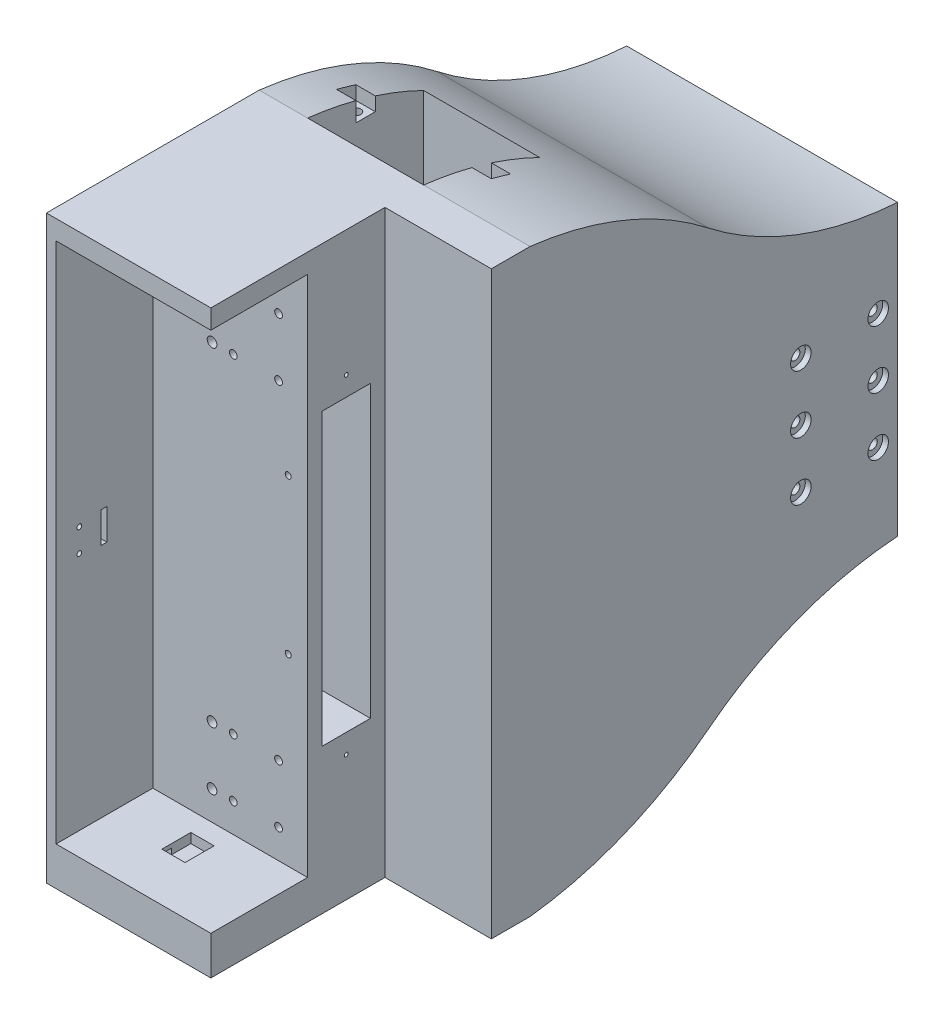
SolidWorks part; units mm, degrees
ref_plane "前视基准面" through (0, 0, 0) normal (0, 0, 1) x (1, 0, 0)
ref_plane "上视基准面" through (0, 0, 0) normal (0, 1, 0) x (1, 0, 0)
ref_plane "右视基准面" through (0, 0, 0) normal (1, 0, 0) x (0, 0, -1)
other "Configuration Table"
sketch "草图1" plane through (0, 0, 0) normal (0, 1, 0) x (1, 0, 0)
  line L0 (0, 0) -> (140, 0)
  line L1 (140, 0) -> (140, -20)
  line L2 (140, -20) -> (85, -20)
  line L3 (85, -20) -> (85, -100)
  line L4 (85, -100) -> (0, -100)
  line L5 (0, -100) -> (0, 0)
  dimension "D1" = 140
  dimension "D2" = 100
  dimension "D3" = 80
  dimension "D4" = 55
extrude "凸台-拉伸1" add sketch "草图1" along normal blind 300
sketch "草图3" plane through (85, 0, 0) normal (1, 0, 0) x (0, 0, -1)
  line L0 (-100, 0) -> (-100, 10)
  line L1 (-100, 10) -> (-50, 10)
  line L2 (-50, 10) -> (-50, 290)
  line L3 (-50, 290) -> (-100, 290)
  line L4 (-100, 0) -> (-20, 0)
  line L5 (-20, 0) -> (-20, 300)
  line L6 (-20, 300) -> (-100, 300)
  line L7 (-100, 300) -> (-100, 0)
  line L8 (-100, 0) -> (-20, 0)
  line L9 (-20, 0) -> (-20, 300)
  line L10 (-20, 300) -> (-100, 300)
  line L11 (-100, 300) -> (-100, 0)
  line L12 (-100, 290) -> (-100, 10)
  dimension "D2" = 10
  dimension "D3" = 10
  dimension "D4" = 50
  dimension "D1" = 0
extrude "切除-拉伸1" cut sketch "草图3" against normal blind 80 contours L2 L3 L1 M10
sketch "草图5" plane through (0, 0, 50) normal (0, 0, 1) x (1, 0, 0)
  line L0 (70, 10) -> (70, 35)
  line L1 (70, 35) -> (85, 35)
  line L2 (46.6, 35) -> (46.6, 65) construction
  line L3 (46.6, 65) -> (46.6, 265) construction
  line L4 (85, 10) -> (85, 290)
  line L5 (85, 290) -> (5, 290)
  line L6 (5, 290) -> (5, 10)
  line L7 (5, 10) -> (85, 10)
  line L8 (85, 10) -> (85, 290)
  line L9 (85, 290) -> (5, 290)
  line L10 (5, 290) -> (5, 10)
  line L11 (5, 10) -> (85, 10)
  circle A0 centre (70, 35) radius 2
  circle A1 centre (46.6, 35) radius 2
  circle A2 centre (46.6, 65) radius 2
  circle A3 centre (70, 65) radius 2
  circle A4 centre (46.6, 265) radius 2
  circle A5 centre (46.6, 235) radius 2
  circle A6 centre (70, 235) radius 2
  circle A7 centre (70, 265) radius 2
  dimension "D4" = 4
  dimension "D2" = 25
  dimension "D3" = 15
  dimension "D6" = 23.4
  dimension "D8" = 30
  dimension "D10" = 200
  dimension "D1" = 0
  dimension "D5" = 2
  dimension "D7" = 2
  dimension "D9" = 2
extrude "切除-拉伸2" cut sketch "草图5" against normal blind 50 contours A2 | A3 | A1 | L1 A0 L0 | L0 A0 L1 | A6 | A4 | A7 | A5
sketch "草图9" plane through (0, 0, 50) normal (0, 0, 1) x (1, 0, 0)
  line L0 (46.6, 265) -> (35.6, 265)
  line L1 (46.6, 235) -> (35.6, 235)
  line L2 (46.6, 65) -> (35.6, 65)
  line L3 (46.6, 35) -> (35.6, 35)
  circle A0 centre (46.6, 265) radius 2 construction
  circle A1 centre (46.6, 265) radius 2
  circle A2 centre (46.6, 235) radius 2 construction
  circle A3 centre (46.6, 235) radius 2
  circle A4 centre (46.6, 65) radius 2 construction
  circle A5 centre (46.6, 65) radius 2
  circle A6 centre (46.6, 35) radius 2 construction
  circle A7 centre (46.6, 35) radius 2
  circle A8 centre (35.6, 265) radius 2.5
  circle A9 centre (35.6, 235) radius 2.5
  circle A10 centre (35.6, 65) radius 2.5
  circle A11 centre (35.6, 35) radius 2.5
  dimension "D3" = 5
  dimension "D4" = 5
  dimension "D7" = 5
  dimension "D8" = 5
  dimension "D1" = 11
  dimension "D2" = 11
  dimension "D5" = 11
  dimension "D6" = 11
extrude "切除-拉伸3" cut sketch "草图9" against normal blind 50
sketch "草图11" plane through (0, 0, 0) normal (0, 0, -1) x (-1, 0, 0)
  line L4 (-140, 0) -> (0, 0)
  line L5 (0, 0) -> (0, 300)
  line L6 (0, 300) -> (-140, 300)
  line L7 (-140, 300) -> (-140, 0)
  line L8 (-140, 0) -> (0, 0)
  line L9 (0, 0) -> (0, 300)
  line L10 (0, 300) -> (-140, 300)
  line L11 (-140, 300) -> (-140, 0)
  circle A0 centre (-35.6, 35) radius 2.5 construction
  circle A1 centre (-46.6, 235) radius 2
  circle A2 centre (-46.6, 235) radius 2
  circle A3 centre (-70, 265) radius 2
  circle A4 centre (-70, 265) radius 2
  circle A5 centre (-46.6, 265) radius 2
  circle A6 centre (-46.6, 265) radius 2
  circle A7 centre (-70, 235) radius 2
  circle A8 centre (-70, 235) radius 2
  circle A9 centre (-35.6, 235) radius 2.5
  circle A10 centre (-35.6, 235) radius 2.5
  circle A11 centre (-35.6, 265) radius 2.5
  circle A12 centre (-35.6, 265) radius 2.5
  circle A13 centre (-35.6, 65) radius 2.5 construction
  circle A14 centre (-46.6, 65) radius 2 construction
  circle A15 centre (-46.6, 35) radius 2 construction
  circle A16 centre (-70, 35) radius 2 construction
  circle A17 centre (-70, 65) radius 2 construction
  circle A18 centre (-35.6, 35) radius 2.5
  circle A19 centre (-35.6, 65) radius 2.5
  circle A20 centre (-46.6, 65) radius 2
  circle A21 centre (-46.6, 35) radius 2
  circle A22 centre (-70, 35) radius 2
  circle A23 centre (-70, 65) radius 2
  dimension "D1" = 0
  dimension "D2" = 0
  dimension "D3" = 0
  dimension "D4" = 0
  dimension "D5" = 0
  dimension "D6" = 0
  dimension "D7" = 0
extrude "凸台-拉伸3" add sketch "草图11" along normal blind 10
sketch "草图12" plane through (0, 0, 20) normal (0, 0, 1) x (1, 0, 0)
  line L4 (85, 0) -> (140, 0)
  line L5 (140, 0) -> (140, 300)
  line L6 (140, 300) -> (85, 300)
  line L7 (85, 300) -> (85, 0)
  line L8 (85, 0) -> (140, 0)
  line L9 (140, 0) -> (140, 300)
  line L10 (140, 300) -> (85, 300)
  line L11 (85, 300) -> (85, 0)
  dimension "D1" = 0
extrude "切除-拉伸4" cut sketch "草图12" against normal blind 10
sketch "草图13" plane through (140, 0, 0) normal (1, 0, 0) x (0, 0, -1)
  line L0 (10, 150) -> (10, 224.75)
  line L1 (200, 150) -> (200, 75.25)
  line L2 (200, 150) -> (200, 224.75)
  line L3 (200, 150) -> (-49800, 150) construction
  line L4 (-10, 300) -> (-10, 0)
  line L5 (-10, 0) -> (10, 0)
  line L6 (10, 0) -> (10, 300)
  line L7 (10, 300) -> (-10, 300)
  line L8 (-10, 300) -> (-10, 0)
  line L9 (-10, 0) -> (10, 0)
  line L10 (10, 0) -> (10, 300)
  line L11 (10, 300) -> (-10, 300)
  arc A0 (200, 224.75) -> (102.1356, 262.2094) centre (212.2529, 403.3284) cw
  arc A1 (102.1356, 37.7906) -> (10, 0) centre (-11.3173, 183.1842) cw
  arc A2 (102.1356, 262.2094) -> (10, 300) centre (-11.3173, 116.8158) ccw
  arc A3 (200, 75.25) -> (102.1356, 37.7906) centre (212.2529, -103.3284) ccw
  dimension "D2" = 74.75
  dimension "D4" = 190
  dimension "D1" = 0
  dimension "D3" = 2
extrude "凸台-拉伸4" add sketch "草图13" against normal up to surface (140 mm away)
sketch "草图15" plane through (0, 0, 0) normal (-1, 0, 0) x (0, 0, 1)
  line L0 (-10, 300) -> (100, 300) construction
  line L1 (-10, 300) -> (100, 300)
  line L2 (-10, 0) -> (100, 0) construction
  line L3 (-10, 0) -> (100, 0)
  line L4 (-10, 0) -> (-10, 80)
  line L5 (-10, 300) -> (-10, 220)
  line L6 (-10, 80) -> (-70, 80)
  line L7 (-10, 220) -> (-70, 220)
  line L8 (-70, 80) -> (-70, 17.6597)
  line L9 (-70, 220) -> (-70, 282.3403)
  arc A0 (-102.1356, 37.7906) -> (-10, 0) centre (11.3173, 183.1842) ccw construction
  arc A1 (-10, 300) -> (-102.1356, 262.2094) centre (11.3173, 116.8158) ccw construction
  arc A2 (-10, 300) -> (-102.1356, 262.2094) centre (11.3173, 116.8158) ccw
  arc A3 (-102.1356, 37.7906) -> (-10, 0) centre (11.3173, 183.1842) ccw
  dimension "D3" = 60
  dimension "D1" = 80
  dimension "D2" = 80
  dimension "D4" = 60
extrude "切除-拉伸5" cut sketch "草图15" against normal blind 60 from offset 25 contours L6 L8 L4 M12 | L9 L7 L5 M8
sketch "草图16" plane through (85, 0, 0) normal (1, 0, 0) x (0, 0, -1)
  line L0 (-50, 150) -> (-42.5, 150)
  line L1 (-42.5, 75) -> (-42.5, 225)
  line L2 (-42.5, 225) -> (-17.5, 225)
  line L3 (-17.5, 225) -> (-17.5, 75)
  line L4 (-17.5, 150) -> (-42.5, 150)
  line L5 (-42.5, 75) -> (-17.5, 75)
  line L8 (-50, 290) -> (-50, 10)
  line L9 (-50, 10) -> (-100, 10)
  line L10 (-100, 10) -> (-100, 0)
  line L11 (-100, 0) -> (-10, 0)
  line L12 (-10, 0) -> (-10, 300)
  line L13 (-10, 300) -> (-100, 300)
  line L14 (-100, 300) -> (-100, 290)
  line L15 (-100, 290) -> (-50, 290)
  line L16 (-50, 290) -> (-50, 10)
  line L17 (-50, 10) -> (-100, 10)
  line L18 (-100, 10) -> (-100, 0)
  line L19 (-100, 0) -> (-10, 0)
  line L20 (-10, 0) -> (-10, 300)
  line L21 (-10, 300) -> (-100, 300)
  line L22 (-100, 300) -> (-100, 290)
  line L23 (-100, 290) -> (-50, 290)
  dimension "D2" = 7.5
  dimension "D3" = 25
  dimension "D4" = 75
  dimension "D1" = 0
extrude "切除-拉伸6" cut sketch "草图16" against normal blind 60 contours L4 L3 L2 L1 | L1 L5 L3 L4
sketch "草图17" plane through (0, 0, -200) normal (0, 0, -1) x (-1, 0, 0)
  line L1 (-120, 194.75) -> (-20, 194.75)
  line L2 (-120, 194.75) -> (-120, 105.25)
  line L3 (-120, 105.25) -> (-20, 105.25)
  line L4 (0, 75.25) -> (0, 224.75)
  line L5 (0, 224.75) -> (-140, 224.75)
  line L6 (-140, 224.75) -> (-140, 75.25)
  line L7 (-140, 75.25) -> (0, 75.25)
  line L8 (0, 75.25) -> (0, 224.75)
  line L9 (0, 224.75) -> (-140, 224.75)
  line L10 (-140, 224.75) -> (-140, 75.25)
  line L11 (-140, 75.25) -> (0, 75.25)
  line L12 (-20, 194.75) -> (-20, 105.25)
  line L13 (-120, 194.75) -> (-20, 105.25) construction
  line L14 (-120, 105.25) -> (-20, 194.75) construction
  point P2 (-70, 150)
  dimension "D2" = 100
  dimension "D3" = 89.5
  dimension "D4" = 20
  dimension "D5" = 30
  dimension "D1" = 0
extrude "切除-拉伸8" cut sketch "草图17" against normal blind 61 contours L12 L1 L2 L3
sketch "草图19" plane through (20, 0, 0) normal (1, 0, 0) x (0, 0, -1)
  line L0 (200, 150) -> (139, 150)
  line L1 (190, 150) -> (150, 150) construction
  line L2 (190, 150) -> (190, 180) construction
  line L4 (200, 105.25) -> (200, 194.75)
  line L5 (200, 194.75) -> (139, 194.75)
  line L6 (139, 194.75) -> (139, 105.25)
  line L7 (139, 105.25) -> (200, 105.25)
  line L8 (200, 105.25) -> (200, 194.75)
  line L9 (200, 194.75) -> (139, 194.75)
  line L10 (139, 194.75) -> (139, 105.25)
  line L11 (139, 105.25) -> (200, 105.25)
  circle A0 centre (190, 150) radius 2.5
  circle A1 centre (150, 150) radius 2.5
  circle A2 centre (150, 180) radius 2.5
  circle A3 centre (190, 180) radius 2.5
  circle A4 centre (150, 120) radius 2.5
  circle A5 centre (190, 120) radius 2.5
  dimension "D2" = 5
  dimension "D3" = 10
  dimension "D6" = 40
  dimension "D7" = 30
  dimension "D1" = 0
  dimension "D4" = 2
  dimension "D5" = 2
extrude "切除-拉伸9" cut sketch "草图19" against normal through all both and the other way through all contours A3 | A2 | A1 | A0 | A5 | A4
sketch "草图20" plane through (140, 0, 0) normal (1, 0, 0) x (0, 0, -1)
  circle A0 centre (150, 120) radius 2.5 construction
  circle A1 centre (190, 120) radius 2.5 construction
  circle A2 centre (190, 150) radius 2.5 construction
  circle A3 centre (150, 150) radius 2.5 construction
  circle A4 centre (150, 180) radius 2.5 construction
  circle A5 centre (190, 180) radius 2.5 construction
  circle A6 centre (150, 120) radius 2.5
  circle A7 centre (190, 120) radius 2.5
  circle A8 centre (190, 150) radius 2.5
  circle A9 centre (150, 150) radius 2.5
  circle A10 centre (150, 180) radius 2.5
  circle A11 centre (190, 180) radius 2.5
  circle A12 centre (190, 180) radius 5.3
  circle A13 centre (150, 180) radius 5.3
  circle A14 centre (150, 150) radius 5.3
  circle A15 centre (190, 150) radius 5.3
  circle A16 centre (190, 120) radius 5.3
  circle A17 centre (150, 120) radius 5.3
  dimension "D1" = 10.6
  dimension "D2" = 10.6
  dimension "D3" = 10.6
  dimension "D4" = 10.6
  dimension "D5" = 10.6
  dimension "D6" = 10.6
extrude "切除-拉伸10" cut sketch "草图20" against normal blind 3 and the other way through all
sketch "草图21" plane through (0, 0, 0) normal (-1, 0, 0) x (0, 0, 1)
  circle A0 centre (-150, 120) radius 5.3 construction
  circle A1 centre (-150, 150) radius 5.3
  circle A2 centre (-150, 150) radius 5.3
  circle A3 centre (-150, 180) radius 5.3 construction
  circle A4 centre (-190, 180) radius 5.3 construction
  circle A5 centre (-190, 150) radius 5.3 construction
  circle A6 centre (-190, 120) radius 5.3 construction
  circle A7 centre (-150, 120) radius 5.3
  circle A8 centre (-150, 180) radius 5.3
  circle A9 centre (-190, 180) radius 5.3
  circle A10 centre (-190, 150) radius 5.3
  circle A11 centre (-190, 120) radius 5.3
  dimension "D1" = 0
extrude "切除-拉伸11" cut sketch "草图21" against normal blind 3
sketch "草图22" plane through (0, 0, -139) normal (0, 0, -1) x (-1, 0, 0)
  line L0 (-70, 194.75) -> (-70, 105.25)
  line L1 (-120, 150) -> (-20, 150)
  line L3 (-105.5, 185.5) -> (-34.5, 185.5)
  line L4 (-20, 105.25) -> (-20, 194.75)
  line L5 (-20, 194.75) -> (-120, 194.75)
  line L6 (-120, 194.75) -> (-120, 105.25)
  line L7 (-120, 105.25) -> (-20, 105.25)
  line L8 (-20, 105.25) -> (-20, 194.75)
  line L9 (-20, 194.75) -> (-120, 194.75)
  line L10 (-120, 194.75) -> (-120, 105.25)
  line L11 (-120, 105.25) -> (-20, 105.25)
  line L12 (-105.5, 185.5) -> (-105.5, 114.5)
  line L13 (-105.5, 114.5) -> (-34.5, 114.5)
  line L14 (-34.5, 185.5) -> (-34.5, 114.5)
  line L15 (-105.5, 185.5) -> (-34.5, 114.5) construction
  line L16 (-105.5, 114.5) -> (-34.5, 185.5) construction
  point P8 (-70, 150)
  dimension "D2" = 71
  dimension "D3" = 71
  dimension "D1" = 0
extrude "切除-拉伸12" cut sketch "草图22" against normal blind 71 contours L3 L12 L1 L0 | L14 L3 L0 L1 | L14 L1 L0 L13 | L12 L13 L0 L1
sketch "草图23" plane through (0, 0, 0) normal (-1, 0, 0) x (0, 0, 1)
  line L0 (100, 150) -> (90, 150)
  line L1 (90, 160) -> (90, 140)
  line L2 (90, 140) -> (70, 140)
  line L3 (70, 140) -> (70, 160)
  line L4 (-10, 0) -> (100, 0)
  line L5 (100, 0) -> (100, 300)
  line L6 (100, 300) -> (-10, 300)
  line L7 (-200, 224.75) -> (-200, 75.25)
  line L8 (-10, 0) -> (100, 0)
  line L9 (100, 0) -> (100, 300)
  line L10 (100, 300) -> (-10, 300)
  line L11 (-200, 224.75) -> (-200, 75.25)
  line L12 (70, 150) -> (90, 150)
  line L13 (90, 160) -> (70, 160)
  arc A4 (-10, 300) -> (-102.1356, 262.2094) centre (11.3173, 116.8158) ccw
  arc A5 (-200, 224.75) -> (-102.1356, 262.2094) centre (-212.2529, 403.3284) ccw
  arc A6 (-102.1356, 37.7906) -> (-200, 75.25) centre (-212.2529, -103.3284) ccw
  arc A7 (-102.1356, 37.7906) -> (-10, 0) centre (11.3173, 183.1842) ccw
  arc A8 (-10, 300) -> (-102.1356, 262.2094) centre (11.3173, 116.8158) ccw
  arc A9 (-200, 224.75) -> (-102.1356, 262.2094) centre (-212.2529, 403.3284) ccw
  arc A10 (-102.1356, 37.7906) -> (-200, 75.25) centre (-212.2529, -103.3284) ccw
  arc A11 (-102.1356, 37.7906) -> (-10, 0) centre (11.3173, 183.1842) ccw
  dimension "D2" = 10
  dimension "D3" = 20
  dimension "D4" = 10
  dimension "D1" = 0
extrude "切除-拉伸13" cut sketch "草图23" against normal blind 2 contours L12 L3 L2 L1 | L1 L13 L3 L12
sketch "草图24" plane through (2, 0, 0) normal (-1, 0, 0) x (0, 0, 1)
  line L0 (70, 142) -> (73.75, 142)
  line L1 (73.75, 142) -> (73.75, 140)
  line L3 (73.75, 142) -> (76.75, 142)
  line L4 (90, 140) -> (90, 160)
  line L5 (90, 160) -> (70, 160)
  line L6 (70, 160) -> (70, 140)
  line L7 (70, 140) -> (90, 140)
  line L8 (90, 140) -> (90, 160)
  line L9 (90, 160) -> (70, 160)
  line L10 (70, 160) -> (70, 140)
  line L11 (70, 140) -> (90, 140)
  line L12 (73.75, 142) -> (73.75, 158)
  line L13 (73.75, 158) -> (76.75, 158)
  line L14 (76.75, 142) -> (76.75, 158)
  dimension "D2" = 3.75
  dimension "D3" = 2
  dimension "D4" = 16
  dimension "D5" = 3
  dimension "D1" = 0
extrude "切除-拉伸14" cut sketch "草图24" against normal blind 12 contours L3 L14 L13 L12
sketch "草图25" plane through (2, 0, 0) normal (-1, 0, 0) x (0, 0, 1)
  line L0 (90, 150) -> (88, 150)
  line L1 (88, 150) -> (88, 156)
  line L4 (90, 140) -> (90, 160)
  line L5 (90, 160) -> (70, 160)
  line L6 (70, 160) -> (70, 140)
  line L7 (70, 140) -> (90, 140)
  line L8 (90, 140) -> (90, 160)
  line L9 (90, 160) -> (70, 160)
  line L10 (70, 160) -> (70, 140)
  line L11 (70, 140) -> (90, 140)
  circle A0 centre (88, 156) radius 1.25
  circle A1 centre (88, 144) radius 1.25
  dimension "D4" = 2.5
  dimension "D2" = 2
  dimension "D3" = 6
  dimension "D1" = 0
extrude "切除-拉伸15" cut sketch "草图25" against normal blind 12
sketch "草图26" plane through (0, 10, 0) normal (0, 1, 0) x (1, 0, 0)
  line L4 (85, -100) -> (85, -50)
  line L5 (85, -50) -> (5, -50)
  line L6 (5, -50) -> (5, -100)
  line L7 (5, -100) -> (85, -100)
  line L8 (85, -100) -> (85, -50)
  line L9 (85, -50) -> (5, -50)
  line L10 (5, -50) -> (5, -100)
  line L11 (5, -100) -> (85, -100)
  dimension "D1" = 0
extrude "凸台-拉伸5" add sketch "草图26" along normal blind 10
sketch "草图28" plane through (0, 0, 0) normal (0, -1, 0) x (1, 0, 0)
  line L0 (0, -10) -> (0, 100) construction
  line L1 (0, -10) -> (0, 100)
  line L2 (40.6621, 100) -> (40.6621, 91)
  line L3 (40.6621, 91) -> (17.6621, 91)
  line L4 (17.6621, 91) -> (17.6621, 70)
  line L5 (17.6621, 70) -> (63.6621, 70)
  line L6 (63.6621, 70) -> (63.6621, 91)
  line L7 (63.6621, 91) -> (40.6621, 91)
  line L10 (140, 10) -> (85, 10)
  line L11 (85, 10) -> (85, 100)
  line L12 (85, 100) -> (0, 100)
  line L13 (0, 100) -> (0, -10)
  line L14 (0, -10) -> (25, -10)
  line L15 (25, -10) -> (85, -10)
  line L16 (85, -10) -> (140, -10)
  line L17 (140, -10) -> (140, 10)
  line L18 (140, 10) -> (85, 10)
  line L19 (85, 10) -> (85, 100)
  line L20 (85, 100) -> (0, 100)
  line L21 (0, 100) -> (0, -10)
  line L22 (0, -10) -> (25, -10)
  line L23 (25, -10) -> (85, -10)
  line L24 (85, -10) -> (140, -10)
  line L25 (140, -10) -> (140, 10)
  dimension "D2" = 9
  dimension "D3" = 46
  dimension "D4" = 23
  dimension "D5" = 21
  dimension "D1" = 0
extrude "切除-拉伸16" cut sketch "草图28" against normal blind 18 contours L6 L7 L3 L4 L5
sketch "草图29" plane through (0, 18, 0) normal (0, -1, 0) x (1, 0, 0)
  line L0 (40.6621, 70) -> (46.6621, 70)
  line L1 (46.6621, 70) -> (46.6621, 75)
  line L2 (46.6621, 75) -> (34.6621, 75)
  line L3 (34.6621, 75) -> (34.6621, 70)
  line L4 (63.6621, 70) -> (63.6621, 91)
  line L5 (63.6621, 91) -> (17.6621, 91)
  line L6 (17.6621, 91) -> (17.6621, 70)
  line L7 (17.6621, 70) -> (63.6621, 70)
  line L8 (63.6621, 70) -> (63.6621, 91)
  line L9 (63.6621, 91) -> (17.6621, 91)
  line L10 (17.6621, 91) -> (17.6621, 70)
  line L11 (17.6621, 70) -> (63.6621, 70)
  line L12 (34.6621, 70) -> (40.6621, 70)
  dimension "D2" = 12
  dimension "D3" = 5
  dimension "D4" = 6
  dimension "D1" = 0
extrude "切除-拉伸17" cut sketch "草图29" against normal blind 10 contours L2 L3 L1 M13
sketch "草图30" plane through (0, 20, 0) normal (0, 1, 0) x (1, 0, 0)
  line L0 (46.6621, -70) -> (34.6621, -70) construction
  line L1 (46.6621, -70) -> (34.6621, -70)
  line L2 (46.6621, -75) -> (46.6621, -70) construction
  line L3 (46.6621, -75) -> (46.6621, -70)
  line L4 (5, -100) -> (85, -100)
  line L5 (85, -100) -> (85, -50)
  line L6 (85, -50) -> (5, -50)
  line L7 (5, -50) -> (5, -100)
  line L8 (5, -100) -> (85, -100)
  line L9 (85, -100) -> (85, -50)
  line L10 (85, -50) -> (5, -50)
  line L11 (5, -50) -> (5, -100)
  line L12 (34.6621, -75) -> (46.6621, -75) construction
  line L13 (34.6621, -70) -> (34.6621, -75) construction
  line L14 (34.6621, -75) -> (46.6621, -75)
  line L15 (34.6621, -70) -> (34.6621, -75)
  line L16 (34.6621, -70) -> (34.6621, -60)
  line L17 (34.6621, -60) -> (46.6621, -60)
  line L18 (46.6621, -60) -> (46.6621, -70)
  dimension "D2" = 10
  dimension "D1" = 0
extrude "切除-拉伸18" cut sketch "草图30" against normal blind 5 contours L18 L17 L16 M8
sketch "草图31" plane through (85, 0, 0) normal (1, 0, 0) x (0, 0, -1)
  line L0 (-30, 225) -> (-30, 235)
  line L1 (-30, 75) -> (-30, 65)
  line L4 (-42.5, 225) -> (-42.5, 75)
  line L5 (-42.5, 75) -> (-17.5, 75)
  line L6 (-17.5, 75) -> (-17.5, 225)
  line L7 (-17.5, 225) -> (-42.5, 225)
  line L8 (-50, 290) -> (-50, 20)
  line L9 (-50, 20) -> (-100, 20)
  line L10 (-100, 20) -> (-100, 0)
  line L11 (-100, 0) -> (-10, 0)
  line L12 (-10, 0) -> (-10, 300)
  line L13 (-10, 300) -> (-100, 300)
  line L14 (-100, 300) -> (-100, 290)
  line L15 (-100, 290) -> (-50, 290)
  line L16 (-50, 290) -> (-50, 20)
  line L17 (-50, 20) -> (-100, 20)
  line L18 (-100, 20) -> (-100, 0)
  line L19 (-100, 0) -> (-10, 0)
  line L20 (-10, 0) -> (-10, 300)
  line L21 (-10, 300) -> (-100, 300)
  line L22 (-100, 300) -> (-100, 290)
  line L23 (-100, 290) -> (-50, 290)
  line L24 (-42.5, 225) -> (-42.5, 75)
  line L25 (-42.5, 75) -> (-17.5, 75)
  line L26 (-17.5, 75) -> (-17.5, 225)
  line L27 (-17.5, 225) -> (-42.5, 225)
  circle A0 centre (-30, 235) radius 1
  circle A1 centre (-30, 65) radius 1
  dimension "D5" = 2
  dimension "D6" = 2
  dimension "D3" = 10
  dimension "D4" = 10
  dimension "D1" = 0
  dimension "D2" = 0
extrude "切除-拉伸19" cut sketch "草图31" against normal blind 20 contours A0 | A1
sketch "草图32" plane through (0, 0, 50) normal (0, 0, 1) x (1, 0, 0)
  line L0 (85, 155) -> (75, 155)
  line L1 (75, 155) -> (75, 195)
  line L4 (5, 290) -> (5, 20)
  line L5 (5, 20) -> (85, 20)
  line L6 (85, 20) -> (85, 290)
  line L7 (85, 290) -> (5, 290)
  line L8 (5, 290) -> (5, 20)
  line L9 (5, 20) -> (85, 20)
  line L10 (85, 20) -> (85, 290)
  line L11 (85, 290) -> (5, 290)
  circle A0 centre (75, 195) radius 1.55
  circle A1 centre (75, 115) radius 1.55
  dimension "D4" = 3.1
  dimension "D2" = 10
  dimension "D3" = 40
  dimension "D1" = 0
extrude "切除-拉伸20" cut sketch "草图32" against normal blind 20 contours A0 | A1
sketch "草图33" plane through (0, 0, 0) normal (-1, 0, 0) x (0, 0, 1)
  line L0 (-10, 285.3251) -> (-35, 285.3251)
  line L1 (-35, 285.3251) -> (-35, 295.3251)
  line L2 (-35, 285.3251) -> (-45, 285.3251)
  line L3 (-70, 282.3403) -> (-70, 220)
  line L4 (-10, 0) -> (100, 0)
  line L5 (100, 0) -> (100, 300)
  line L6 (100, 300) -> (-10, 300)
  line L7 (-200, 224.75) -> (-200, 75.25)
  line L8 (-10, 0) -> (100, 0)
  line L9 (100, 0) -> (100, 300)
  line L10 (100, 300) -> (-10, 300)
  line L11 (-200, 224.75) -> (-200, 75.25)
  line L12 (-70, 220) -> (-10, 220)
  line L13 (-10, 220) -> (-10, 300)
  line L14 (-70, 282.3403) -> (-70, 220)
  line L15 (-70, 220) -> (-10, 220)
  line L16 (-10, 220) -> (-10, 300)
  line L17 (-45, 285.3251) -> (-45, 292.4268)
  line L18 (100, 150) -> (-49900, 150) construction
  line L19 (-35, 14.6749) -> (-35, 4.6749)
  line L20 (-35, 14.6749) -> (-45, 14.6749)
  line L21 (-45, 14.6749) -> (-45, 7.5732)
  arc A0 (-10, 0) -> (-70, 17.6597) centre (11.3173, 183.1842) cw
  arc A1 (-10, 300) -> (-70, 282.3403) centre (11.3173, 116.8158) ccw
  arc A2 (-10, 300) -> (-70, 282.3403) centre (11.3173, 116.8158) ccw
  arc A4 (-10, 300) -> (-102.1356, 262.2094) centre (11.3173, 116.8158) ccw
  arc A5 (-200, 224.75) -> (-102.1356, 262.2094) centre (-212.2529, 403.3284) ccw
  arc A6 (-102.1356, 37.7906) -> (-200, 75.25) centre (-212.2529, -103.3284) ccw
  arc A7 (-102.1356, 37.7906) -> (-10, 0) centre (11.3173, 183.1842) ccw
  arc A9 (-200, 224.75) -> (-102.1356, 262.2094) centre (-212.2529, 403.3284) ccw
  arc A10 (-102.1356, 37.7906) -> (-200, 75.25) centre (-212.2529, -103.3284) ccw
  arc A11 (-102.1356, 37.7906) -> (-10, 0) centre (11.3173, 183.1842) ccw
  point P24 (100, 150)
  dimension "D3" = 25
  dimension "D4" = 10
  dimension "D5" = 10
  dimension "D1" = 0
  dimension "D2" = 0
extrude "切除-拉伸21" cut sketch "草图33" against normal blind 80 from offset 15 contours L17 L2 L1 M19 | L20 L21 L19 M23
sketch "草图34" plane through (0, 14.6749, 0) normal (0, -1, 0) x (1, 0, 0)
  line L0 (20, -35) -> (20, -45)
  line L1 (15, -40) -> (25, -40)
  line L2 (55, -10) -> (55, -50010) construction
  line L3 (85, -10) -> (25, -10) construction
  line L4 (85, -35) -> (85, -45)
  line L5 (85, -45) -> (95, -45)
  line L6 (95, -45) -> (95, -35)
  line L7 (95, -35) -> (85, -35)
  line L8 (85, -35) -> (85, -45)
  line L9 (85, -45) -> (95, -45)
  line L10 (95, -45) -> (95, -35)
  line L11 (95, -35) -> (85, -35)
  line L12 (25, -35) -> (15, -35)
  line L13 (15, -35) -> (15, -45)
  line L14 (15, -45) -> (25, -45)
  line L15 (25, -45) -> (25, -35)
  line L16 (25, -35) -> (15, -35)
  line L17 (15, -35) -> (15, -45)
  line L18 (15, -45) -> (25, -45)
  line L19 (25, -45) -> (25, -35)
  circle A0 centre (20, -40) radius 2.5
  circle A1 centre (90, -40) radius 2.5
  point P18 (55, -10)
  dimension "D3" = 5
  dimension "D1" = 0
  dimension "D2" = 0
extrude "切除-拉伸22" cut sketch "草图34" against normal blind 20 contours A0 | A1
sketch "草图35" plane through (0, 285.3251, 0) normal (0, 1, 0) x (1, 0, 0)
  circle A0 centre (90, 40) radius 2.5 construction
  circle A1 centre (90, 40) radius 2.5
  circle A2 centre (20, 40) radius 2.5 construction
  circle A3 centre (20, 40) radius 2.5
extrude "切除-拉伸23" cut sketch "草图35" against normal blind 20
